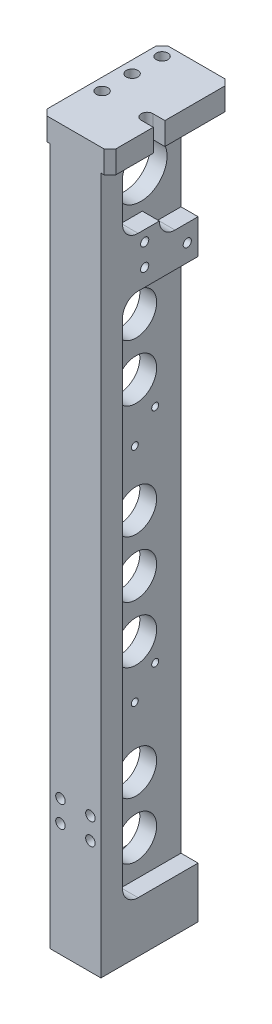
SolidWorks part; units mm, degrees
ref_plane "Front" through (0, 0, 0) normal (0, 0, 1) x (1, 0, 0)
ref_plane "Top" through (0, 0, 0) normal (0, 1, 0) x (1, 0, 0)
ref_plane "center" through (0, 0, 0) normal (1, 0, 0) x (0, 0, -1)
sketch "Sketch1" plane through (0, 0, 0) normal (0, 1, 0) x (1, 0, 0)
  line L1 (-10.795, 41.148) -> (10.795, 41.148)
  line L2 (-10.795, 41.148) -> (-10.795, 0)
  line L3 (-10.795, 0) -> (10.795, 0)
  line L4 (10.795, 41.148) -> (10.795, 0)
  dimension "D1" = 21.59
  dimension "D2" = 41.148
extrude "Extrude1" add sketch "Sketch1" along normal blind 304.8
sketch "Sketch2" plane through (10.795, 0, 0) normal (1, 0, 0) x (0, 0, -1)
  line L0 (41.148, 304.8) -> (41.148, 0) construction
  line L1 (41.148, 295.275) -> (9.144, 295.275)
  line L2 (41.148, 295.275) -> (41.148, 21.59)
  line L3 (41.148, 21.59) -> (9.144, 21.59)
  line L4 (9.144, 295.275) -> (9.144, 21.59)
  line L5 (41.148, 304.8) -> (0, 304.8) construction
  line L6 (0, 0) -> (41.148, 0) construction
  line L7 (0, 304.8) -> (0, 0) construction
  dimension "D1" = 9.525
  dimension "D2" = 21.59
  dimension "D3" = 9.144
extrude "Cut-Extrude1" cut sketch "Sketch2" against normal blind 7.239
mirror "Mirror1" about plane through (0, 0, 0) normal (1, 0, 0) of "Cut-Extrude1"
sketch "Sketch3" plane through (10.795, 0, 0) normal (1, 0, 0) x (0, 0, -1)
  line L1 (9.144, 244.094) -> (24.7644, 244.094)
  line L2 (9.144, 244.094) -> (9.144, 265.303)
  line L3 (9.144, 265.303) -> (24.7644, 265.303)
  line L4 (24.7644, 244.094) -> (24.7644, 265.303)
  line L5 (9.144, 295.275) -> (9.144, 21.59) construction
  line L6 (0, 304.8) -> (41.148, 304.8) construction
  dimension "D1" = 39.497
  dimension "D2" = 21.209
  dimension "D3" = 15.6204
extrude "Extrude2" add sketch "Sketch3" against normal up to surface (7.239 mm away)
sketch "Sketch11" plane through (0, 304.8, 0) normal (0, 1, 0) x (-1, 0, 0)
  line L1 (14.605, 0) -> (-14.605, 0)
  line L2 (14.605, 0) -> (14.605, -51.308)
  line L3 (14.605, -51.308) -> (-14.605, -51.308)
  line L4 (-14.605, 0) -> (-14.605, -51.308)
  line L5 (10.795, -41.148) -> (-10.795, -41.148) construction
  point P4 (0, 0)
  dimension "D1" = 10.16
  dimension "D2" = 29.21
extrude "Extrude4" add sketch "Sketch11" against normal up to surface (9.525 mm away)
chamfer "Chamfer1" [suppressed] distance 0.635 angle 45
sketch "Sketch4" plane through (3.556, 0, 0) normal (1, 0, 0) x (0, 0, -1)
  line L0 (41.148, 21.59) -> (41.148, 295.275) construction
  line L1 (24.7644, 244.094) -> (41.148, 244.094)
  line L2 (24.7644, 244.094) -> (24.7644, 258.699)
  line L3 (24.7644, 258.699) -> (41.148, 258.699)
  line L4 (41.148, 244.094) -> (41.148, 258.699)
  line L5 (0, 304.8) -> (51.308, 304.8) construction
  dimension "D1" = 46.101
extrude "Extrude3" add sketch "Sketch4" along normal blind 7.239
fillet "Fillet2" radius 6.604 3 edges at (7.1755, 244.094, -9.144) (7.1755, 265.303, -9.144) (7.1755, 258.699, -24.7644)
hole_wizard "#10-32 Tapped Hole1" positions "Sketch6" profile "Sketch5" tap size "#10-32" standard "Ansi Inch"
sketch "Sketch6" plane through (0, 0, 0) normal (0, -1, 0) x (1, 0, 0)
  line L0 (-10.795, -41.148) -> (-10.795, 0) construction
  line L1 (10.795, -41.148) -> (-10.795, -41.148) construction
  point P0 (-6.731, -37.084)
  dimension "D1" = 4.064
  dimension "D2" = 4.064
sketch "Sketch5" plane through (-6.731, 0, -37.084) normal (1, 0, 0) x (0, 0, -1)
  line L0 (0, 0) -> (0, 17.6174)
  line L1 (0, 17.6174) -> (2.0193, 17.6174)
  line L2 (2.0193, 17.6174) -> (2.0193, 0)
  line L5 (2.0193, 0) -> (0, 0)
  line L10 (0, 17.6174) -> (-2.0193, 17.6174) construction
  line L11 (0, -6.35) -> (0, 107.95) construction
  dimension "Tap Drill Dia." = 4.0386
  dimension "Tap Drill Depth" = 17.6174
  dimension "Drill Angle" = 180
pattern_linear "LPattern1" count 3 spacing 16.51 along (0, 0, 1) count 2 spacing 13.462 along (1, 0, 0) of "#10-32 Tapped Hole1"
fillet "Fillet4" [suppressed] radius 0.762
hole_wizard "#8-32 Tapped Hole1" positions "Sketch8" profile "Sketch7" tap size "#8-32" standard "Ansi Inch"
sketch "Sketch8" plane through (10.795, 0, 0) normal (1, 0, 0) x (0, 0, -1)
  line L0 (36.576, 258.699) -> (36.576, 244.094) construction
  line L1 (41.148, 258.699) -> (31.3684, 258.699) construction
  line L2 (15.748, 244.094) -> (41.148, 244.094) construction
  line L3 (41.148, 244.094) -> (41.148, 258.699) construction
  line L4 (24.7644, 265.303) -> (15.748, 265.303) construction
  point P0 (36.576, 251.3965)
  point P1 (18.542, 260.731)
  point P3 (18.542, 251.3965)
  dimension "D1" = 4.572
  dimension "D2" = 18.034
  dimension "D3" = 4.572
sketch "Sketch7" plane through (10.795, 251.3965, -36.576) normal (0, 1, 0) x (0, 0, -1)
  line L0 (0, 0) -> (0, 10.5272)
  line L1 (0, 10.5272) -> (1.7272, 9.4894)
  line L2 (1.7272, 9.4894) -> (1.7272, 0)
  line L5 (1.7272, 0) -> (0, 0)
  line L10 (0, 10.5272) -> (-1.7272, 9.4894) construction
  line L11 (0, -6.35) -> (0, 107.95) construction
  dimension "Tap Drill Dia." = 3.4544
  dimension "Tap Drill Depth" = 9.4894
  dimension "Drill Angle" = 118
fillet "Fillet1" radius 6.604 5 edges at (-7.1755, 295.275, -9.144) (-7.1755, 21.59, -9.144) (7.1755, 21.59, -9.144) (7.1755, 295.275, -9.144) (0, 295.275, -41.148)
chamfer "Chamfer2" distance 2.54 angle 45 4 edges at (-14.605, 300.0375, 0) (-14.605, 300.0375, -51.308) (14.605, 300.0375, -51.308) (14.605, 300.0375, 0)
hole_wizard "#10 (0.1935) Diameter Hole2" positions "Sketch10" profile "Sketch9" hole size "#10" standard "Ansi Inch"
sketch "Sketch10" plane through (-6.4165, 304.8, 43.8095) normal (0, 1, 0) x (-1, 0, 0)
  line L3 (-18.4815, -95.1175) -> (5.6485, -95.1175) construction
  line L4 (8.1885, -92.5775) -> (8.1885, -46.3495) construction
  point P0 (3.1085, -90.0375)
  dimension "D1" = 5.08
  dimension "D2" = 5.08
sketch "Sketch9" plane through (-9.525, 304.8, -46.228) normal (1, 0, 0) x (0, 0, 1)
  line L0 (0, 0) -> (0, 16.7166)
  line L1 (0, 16.7166) -> (2.4574, 15.24)
  line L2 (2.4574, 15.24) -> (2.4574, 0)
  line L5 (2.4574, 0) -> (0, 0)
  line L10 (0, 16.7166) -> (-2.4575, 15.24) construction
  line L11 (0, -6.35) -> (0, 107.95) construction
  dimension "Hole Dia." = 4.9149
  dimension "Hole Depth" = 15.24
  dimension "Drill Angle" = 118
pattern_linear "LPattern2" count 3 spacing 12.7 along (0, 0, 1) count 2 spacing 19.05 along (1, 0, 0) of "#10 (0.1935) Diameter Hole2"
sketch "Sketch12" plane through (0, 304.8, 0) normal (0, 1, 0) x (-1, 0, 0)
  line L0 (-14.605, -2.54) -> (-14.605, -48.768) construction
  line L1 (-14.605, -18.3705) -> (-9.525, -18.3705)
  line L2 (-14.605, -18.3705) -> (-14.605, -23.2854)
  line L3 (-14.605, -23.2854) -> (-9.525, -23.2854)
  line L4 (-9.525, -18.3705) -> (-9.525, -23.2854)
  circle A0 centre (9.525, -20.828) radius 2.4574 construction
  circle A1 centre (-9.525, -20.828) radius 2.4574 construction
extrude "Cut-Extrude2" cut sketch "Sketch12" against normal up to surface (9.525 mm away)
hole_wizard "#32 (0.116) Diameter Hole1" positions "Sketch14" profile "Sketch13" hole size "#32" standard "Ansi Inch"
sketch "Sketch14" plane through (-3.556, 0, 0) normal (-1, 0, 0) x (0, 0, 1)
  line L0 (-41.148, 0) -> (0, 0) construction
  line L1 (0, 295.275) -> (0, 0) construction
  point P0 (-30.226, 190.881)
  point P1 (-21.59, 180.721)
  point P3 (-21.59, 86.741)
  point P5 (-30.226, 96.901)
  dimension "D1" = 86.741
  dimension "D2" = 96.901
  dimension "D3" = 180.721
  dimension "D4" = 190.881
  dimension "D5" = 21.59
  dimension "D6" = 30.226
  dimension "D7" = 21.59
  dimension "D8" = 30.226
sketch "Sketch13" plane through (-3.556, 190.881, -30.226) normal (0, 1, 0) x (0, 0, 1)
  line L0 (0, 0) -> (0, 18.161)
  line L1 (0, 18.161) -> (1.4732, 18.161)
  line L2 (1.4732, 18.161) -> (1.4732, 0)
  line L5 (1.4732, 0) -> (0, 0)
  line L11 (0, -6.35) -> (0, 107.95) construction
  dimension "Thru Hole Dia." = 2.9464
  dimension "Thru Hole Depth" = 18.161
hole_wizard "11/16 (0.6875) Diameter Hole1" positions "Sketch16" profile "Sketch15" hole size "11/16" standard "Ansi Inch"
sketch "Sketch16" plane through (-3.556, 0, 0) normal (-1, 0, 0) x (0, 0, 1)
  line L0 (-41.148, 21.59) -> (-41.148, 288.671) construction
  line L1 (-15.748, 21.59) -> (-41.148, 21.59) construction
  point P0 (-22.098, 36.83)
  dimension "D1" = 19.05
  dimension "D2" = 15.24
sketch "Sketch15" plane through (-3.556, 36.83, -22.098) normal (0, 1, 0) x (0, 0, 1)
  line L0 (0, 0) -> (0, 18.161)
  line L1 (0, 18.161) -> (8.7312, 18.161)
  line L2 (8.7312, 18.161) -> (8.7312, 0)
  line L5 (8.7312, 0) -> (0, 0)
  line L11 (0, -6.35) -> (0, 107.95) construction
  dimension "Thru Hole Dia." = 17.4625
  dimension "Thru Hole Depth" = 18.161
pattern_linear "LPattern3" count 9 spacing 24.003 along (0, 1, 0) of "11/16 (0.6875) Diameter Hole1"
hole_wizard "7/8 (0.875) Diameter Hole1" positions "Sketch18" profile "Sketch17" hole size "7/8" standard "Ansi Inch"
sketch "Sketch18" plane through (3.556, 0, 0) normal (1, 0, 0) x (0, 0, -1)
  line L0 (24.13, 295.275) -> (24.13, 265.303) construction
  line L1 (48.768, 295.275) -> (23.2854, 295.275) construction
  line L2 (24.7644, 265.303) -> (15.748, 265.303) construction
  line L3 (41.148, 258.699) -> (41.148, 288.671) construction
  point P0 (24.13, 280.289)
  dimension "D1" = 17.018
sketch "Sketch17" plane through (3.556, 280.289, -24.13) normal (0, 1, 0) x (0, 0, -1)
  line L0 (0, 0) -> (0, 18.161)
  line L1 (0, 18.161) -> (11.1125, 18.161)
  line L2 (11.1125, 18.161) -> (11.1125, 0)
  line L5 (11.1125, 0) -> (0, 0)
  line L11 (0, -6.35) -> (0, 107.95) construction
  dimension "Thru Hole Dia." = 22.225
  dimension "Thru Hole Depth" = 18.161
hole_wizard "#10-32 Tapped Hole2" positions "Sketch20" profile "Sketch19" tap size "#10-32" standard "Ansi Inch"
sketch "Sketch20" plane through (0, 0, 0) normal (0, 0, 1) x (1, 0, 0)
  line L0 (-10.795, 0) -> (10.795, 0) construction
  point P0 (-6.35, 57.277)
  point P1 (6.35, 48.133)
  point P3 (6.35, 57.277)
  point P5 (-6.35, 48.133)
  dimension "D1" = 48.133
  dimension "D2" = 57.277
  dimension "D3" = 48.133
  dimension "D4" = 57.277
  dimension "D5" = 6.35
  dimension "D6" = 6.35
  dimension "D7" = 6.35
  dimension "D8" = 6.35
sketch "Sketch19" plane through (-6.35, 57.277, 0) normal (1, 0, 0) x (0, -1, 0)
  line L0 (0, 0) -> (0, 13.2428)
  line L1 (0, 13.2428) -> (2.0193, 12.0294)
  line L2 (2.0193, 12.0294) -> (2.0193, 0)
  line L5 (2.0193, 0) -> (0, 0)
  line L10 (0, 13.2428) -> (-2.0193, 12.0294) construction
  line L11 (0, -6.35) -> (0, 107.95) construction
  dimension "Tap Drill Dia." = 4.0386
  dimension "Tap Drill Depth" = 12.0294
  dimension "Drill Angle" = 118
